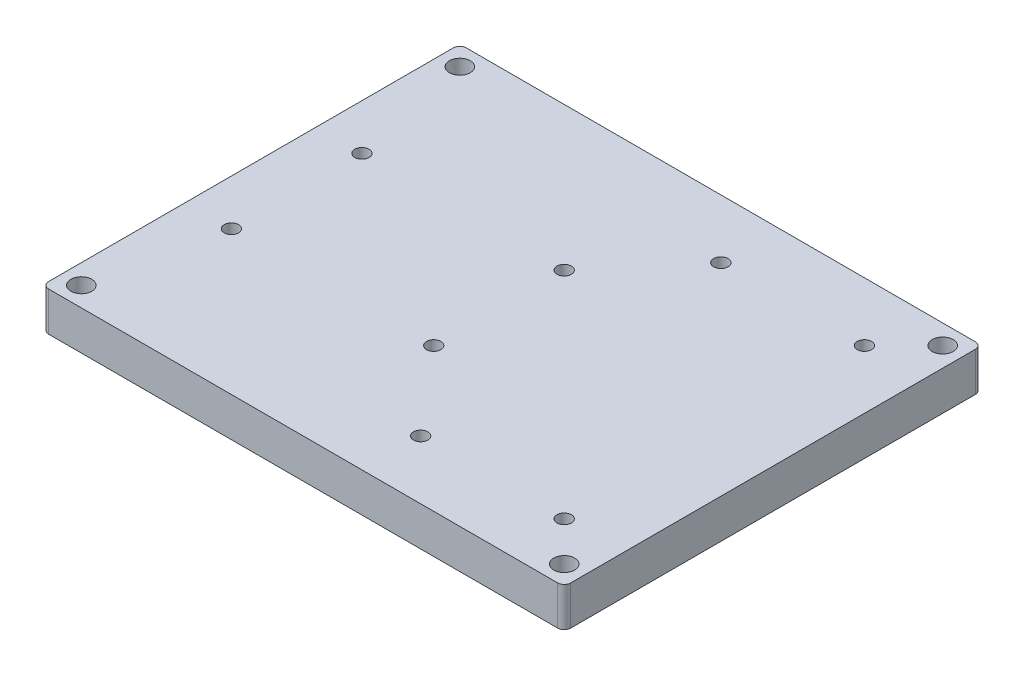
SolidWorks part; units mm, degrees
ref_plane "Plan de face" through (0, 0, 0) normal (0, 0, 1) x (1, 0, 0)
ref_plane "Plan de dessus" through (0, 0, 0) normal (0, 1, 0) x (1, 0, 0)
ref_plane "Plan de droite" through (0, 0, 0) normal (1, 0, 0) x (0, 0, -1)
sketch "Esquisse1" plane through (0, 0, 0) normal (0, 1, 0) x (1, 0, 0)
  line L0 (-9.6017, 32) -> (94.7607, 32) construction
  line L1 (1, 0) -> (79, 0)
  line L2 (0, 1) -> (0, 63)
  line L3 (1, 64) -> (79, 64)
  line L4 (80, 1) -> (80, 63)
  line L5 (-4.1189, 9) -> (88.7107, 9) construction
  line L6 (71, -5.1377) -> (71, 18.6842) construction
  line L7 (49, -5.1377) -> (49, 19.4404) construction
  line L8 (38, 4.7881) -> (38, 26.4357) construction
  line L9 (7, 5.4498) -> (7, 26.4357) construction
  line L10 (-7.5297, 22) -> (40.2162, 22) construction
  line L11 (80, -5.1377) -> (80, 67.1787) construction
  line L12 (-3.2681, 5) -> (84.2678, 5) construction
  line L13 (5, -5.1377) -> (5, 15.281) construction
  line L14 (75, 18.6842) -> (75, -5.1377) construction
  line L15 (77, -5.1377) -> (77, 7.4349) construction
  line L16 (3, -5.1377) -> (3, 11.2162) construction
  line L17 (-2.1338, 3) -> (81.3373, 3) construction
  circle A0 centre (71, 9) radius 1.1
  circle A1 centre (49, 9) radius 1.1
  circle A2 centre (38, 22) radius 1.1
  circle A3 centre (7, 22) radius 1.1
  circle A4 centre (77, 3) radius 1.6
  circle A5 centre (3, 3) radius 1.6
  circle A6 centre (77, 61) radius 1.6
  circle A7 centre (71, 55) radius 1.1
  circle A8 centre (49, 55) radius 1.1
  circle A9 centre (38, 42) radius 1.1
  circle A10 centre (7, 42) radius 1.1
  circle A11 centre (3, 61) radius 1.6
  arc A12 (79, 0) -> (80, 1) centre (79, 1) ccw
  arc A13 (1, 0) -> (0, 1) centre (1, 1) cw
  arc A14 (0, 63) -> (1, 64) centre (1, 63) cw
  arc A15 (79, 64) -> (80, 63) centre (79, 63) cw
  point P61 (0, 0)
  point P66 (80, 64)
  dimension "D13" = 3
  dimension "D16" = 1
  dimension "D1" = 32
  dimension "D2" = 22
  dimension "D3" = 31
  dimension "D4" = 9
  dimension "D5" = 9
  dimension "D6" = 11
  dimension "D7" = 64
  dimension "D8" = 10
  dimension "D9" = 80
  dimension "D10" = 5
  dimension "D11" = 5
  dimension "D12" = 5
  dimension "D14" = 3
  dimension "D15" = 3
extrude "Boss.-Extru.1" add sketch "Esquisse1" along normal blind 6
